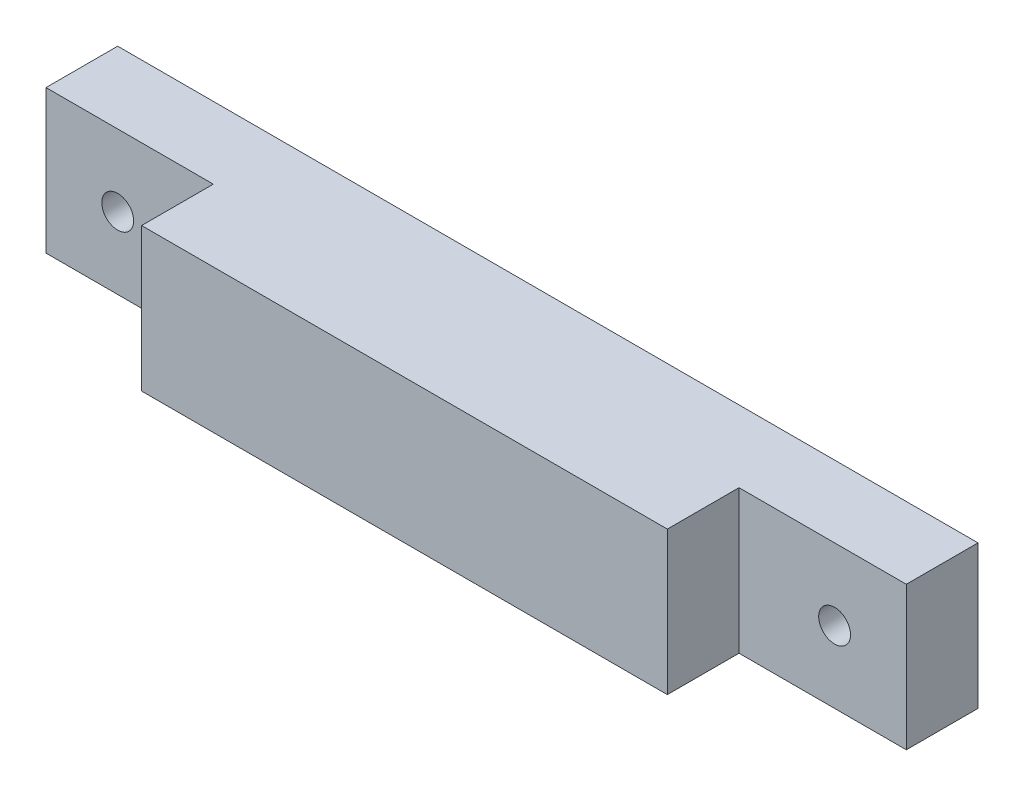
SolidWorks part; units mm, degrees
ref_plane "Plan de face" through (0, 0, 0) normal (0, 0, 1) x (1, 0, 0)
ref_plane "Plan de dessus" through (0, 0, 0) normal (0, 1, 0) x (1, 0, 0)
ref_plane "Plan de droite" through (0, 0, 0) normal (1, 0, 0) x (0, 0, -1)
sketch "Esquisse1" plane through (0, 0, 0) normal (0, 0, 1) x (1, 0, 0)
  line L1 (0, 0) -> (54, 0)
  line L2 (0, 0) -> (0, 9)
  line L3 (0, 9) -> (54, 9)
  line L4 (54, 0) -> (54, 9)
  dimension "D1" = 54
  dimension "D2" = 9
extrude "Extrusion1" add sketch "Esquisse1" along normal blind 9
sketch "Esquisse3" plane through (0, 0, 9) normal (0, 0, 1) x (1, 0, 0)
  line L0 (54, 9) -> (0, 9) construction
  line L1 (0, 0) -> (10.5, 0)
  line L2 (0, 0) -> (0, 9)
  line L3 (0, 9) -> (10.5, 9)
  line L4 (10.5, 0) -> (10.5, 9)
  dimension "D1" = 10.5
extrude "Enlèv. mat.-Extru.1" cut sketch "Esquisse3" against normal blind 4.5
sketch "Esquisse5" plane through (0, 0, 9) normal (0, 0, 1) x (1, 0, 0)
  line L0 (54, 9) -> (10.5, 9) construction
  line L1 (54, 0) -> (43.5, 0)
  line L2 (54, 0) -> (54, 9)
  line L3 (54, 9) -> (43.5, 9)
  line L4 (43.5, 0) -> (43.5, 9)
  dimension "D1" = 10.5
extrude "Enlèv. mat.-Extru.2" cut sketch "Esquisse5" against normal blind 4.5
sketch "Esquisse6" plane through (0, 0, 4.5) normal (0, 0, 1) x (1, 0, 0)
  line L0 (0, 9) -> (0, 0) construction
  line L1 (0, 0) -> (10.5, 0) construction
  circle A0 centre (4.5, 4.5) radius 1
  point P2 (0, 4.5)
  dimension "D2" = 2
  dimension "D1" = 4.5
  dimension "D3" = 4.5
extrude "Enlèv. mat.-Extru.4" cut sketch "Esquisse6" against normal blind 4.5
sketch "Esquisse7" plane through (0, 0, 4.5) normal (0, 0, 1) x (1, 0, 0)
  line L0 (54, 0) -> (54, 9) construction
  line L1 (43.5, 0) -> (54, 0) construction
  circle A0 centre (49.5, 4.5) radius 1
  dimension "D3" = 2
  dimension "D1" = 4.5
  dimension "D2" = 4.5
extrude "Enlèv. mat.-Extru.5" cut sketch "Esquisse7" against normal blind 4.5
